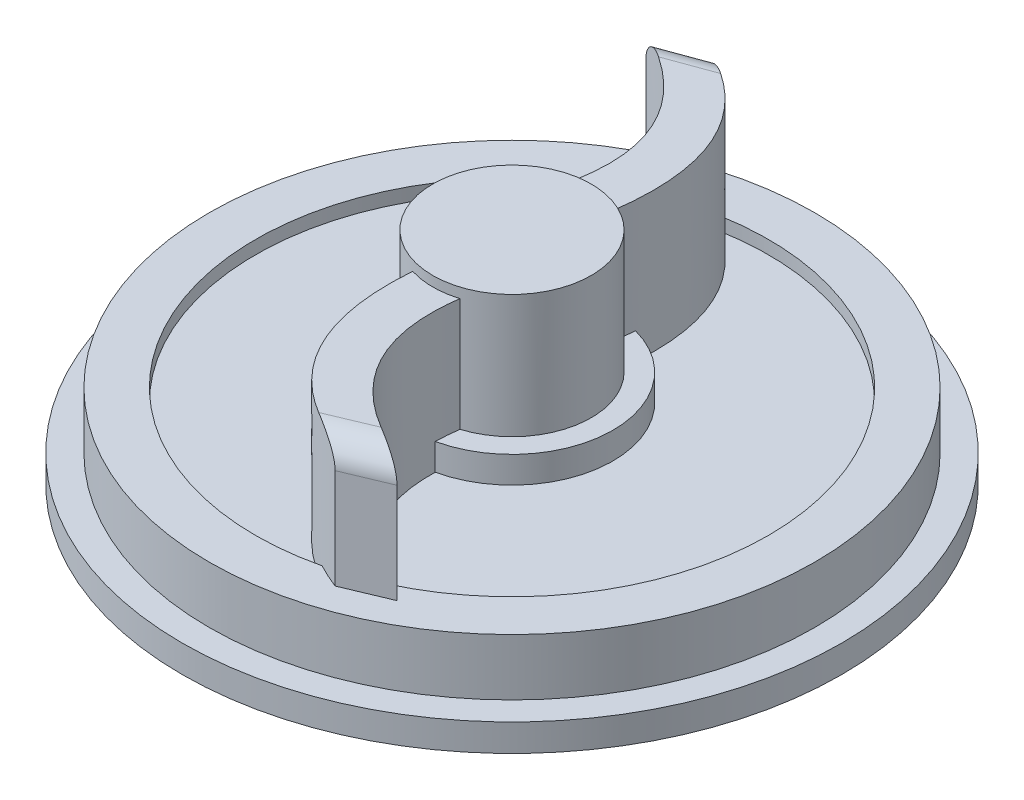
SolidWorks part; units mm, degrees
ref_plane "Front Plane" through (0, 0, 0) normal (0, 0, 1) x (1, 0, 0)
ref_plane "Top Plane" through (0, 0, 0) normal (0, 1, 0) x (1, 0, 0)
ref_plane "Right Plane" through (0, 0, 0) normal (1, 0, 0) x (0, 0, -1)
sketch "Sketch1" plane through (0, 0, 0) normal (0, 1, 0) x (1, 0, 0)
  circle A0 centre (0, 0) radius 12.573
  dimension "D1" = 25.146
extrude "Boss-Extrude1" add sketch "Sketch1" along normal blind 1.0414
sketch "Sketch2" plane through (0, 1.0414, 0) normal (0, 1, 0) x (1, 0, 0)
  line L0 (0, 12.573) -> (0, -12.573) construction
  circle A0 centre (0, 0) radius 12.573 construction
  circle A1 centre (0, 0) radius 11.5443
  dimension "D1" = 23.0886
extrude "Boss-Extrude2" add sketch "Sketch2" along normal blind 2.159
sketch "Sketch3" plane through (0, 3.2004, 0) normal (0, 1, 0) x (1, 0, 0)
  circle A0 centre (0, 0) radius 9.779
  dimension "D1" = 19.558
extrude "Cut-Extrude1" cut sketch "Sketch3" against normal blind 0.508
sketch "Sketch5" plane through (0, 2.6924, 0) normal (0, 1, 0) x (1, 0, 0)
  circle A0 centre (0, 0) radius 3.8481
  dimension "D1" = 7.6962
extrude "Boss-Extrude3" add sketch "Sketch5" along normal blind 1.016
sketch "Sketch6" plane through (0, 3.7084, 0) normal (0, 1, 0) x (1, 0, 0)
  circle A0 centre (0, 0) radius 3.0226
  dimension "D1" = 6.0452
extrude "Boss-Extrude4" add sketch "Sketch6" along normal blind 4.699
sketch "Sketch7" plane through (0, 2.6924, 0) normal (0, 1, 0) x (1, 0, 0)
  line L0 (-0.9017, -2.885) -> (0.9017, -2.885)
  line L1 (0.9017, -2.885) -> (0.2767, -7.3291) construction
  line L2 (0.2767, -7.3291) -> (4.8487, -9.235) construction
  line L4 (-0.9017, -2.885) -> (-1.3121, -8.1823) construction
  line L5 (-1.3121, -8.1823) -> (3.1855, -9.9321) construction
  line L6 (0.2767, -7.3291) -> (-1.3121, -8.1823) construction
  line L7 (-0.9017, -2.885) -> (-0.9017, 2.885) construction
  line L9 (-0.9017, 2.885) -> (0.9017, 2.885)
  line L10 (-4.445, 9.5477) -> (-2.7509, 10.1661)
  line L12 (-4.445, 9.5477) -> (-4.7934, 10.5021) construction
  line L13 (-2.7509, 10.1661) -> (-3.0993, 11.1205) construction
  line L14 (-0.9017, 2.885) -> (0.127, 7.277) construction
  line L15 (4.8487, -9.235) -> (3.1855, -9.9321)
  line L16 (3.1855, -9.9321) -> (3.6176, -10.9628) construction
  line L17 (4.8487, -9.235) -> (5.2808, -10.2657) construction
  line L18 (0.127, 7.277) -> (-4.445, 9.5477) construction
  line L19 (0.9017, 2.885) -> (1.6648, 8.219) construction
  line L20 (1.6648, 8.219) -> (-2.7509, 10.1661) construction
  line L21 (0.127, 7.277) -> (1.6648, 8.219) construction
  circle A0 centre (0, 0) radius 3.0226 construction
  circle A1 centre (0, 0) radius 11.5443 construction
  circle A5 centre (0, 0) radius 3.0226 construction
  circle A6 centre (0, 0) radius 11.5443 construction
  spline S0 degree 2 poles (0.9017, -2.885) (0.2767, -7.3291) (4.8487, -9.235) knots 0 0 0 1 1 1
  spline S1 degree 2 poles (-0.9017, -2.885) (-1.3121, -8.1823) (3.1855, -9.9321) knots 0 0 0 1 1 1
  spline S2 degree 2 poles (-0.9017, 2.885) (0.127, 7.277) (-4.445, 9.5477) knots 0 0 0 1 1 1
  spline S3 degree 2 poles (0.9017, 2.885) (1.6648, 8.219) (-2.7509, 10.1661) knots 0 0 0 1 1 1
  dimension "D1" = 1.8034
  dimension "D2" = 1.8034
  dimension "D3" = 1.1176
  dimension "D4" = 90
  dimension "D5" = 1.1176
  dimension "D6" = 90
  dimension "D7" = 1.8034
  dimension "D8" = 6.35
  dimension "D9" = 4.572
  dimension "D10" = 4.826
  dimension "D11" = 5.2973
  dimension "D12" = 90
  dimension "D13" = 90
  dimension "D14" = 1.016
  dimension "D15" = 1.016
  dimension "D16" = 1.8034
  dimension "D17" = 4.445
  dimension "D18" = 1.8034
  dimension "D19" = 5.334
  dimension "D20" = 4.826
  dimension "D21" = 4.572
extrude "Boss-Extrude6" add sketch "Sketch7" along normal blind 5.334
fillet "Fillet2" radius 1.016 2 edges at (4.0171, 8.0264, 9.5836)
fillet "Fillet3" radius 1.016 2 edges at (-3.598, 8.0264, -9.8569)
sketch "Sketch8" plane through (0, 0, 0) normal (0, -1, 0) x (1, 0, 0)
  circle A0 centre (0, 0) radius 10.0584
  dimension "D1" = 20.1168
extrude "Cut-Extrude2" cut sketch "Sketch8" against normal blind 0.762
sketch "Sketch9" plane through (0, 0.762, 0) normal (0, -1, 0) x (1, 0, 0)
  line L5 (-1.5716, -1.5484) -> (1.5716, 1.5484) construction
  line L6 (-1.5716, 1.5484) -> (1.5716, -1.5484) construction
  circle A0 centre (0, 0) radius 3.3909
  dimension "D1" = 6.7818
extrude "Boss-Extrude7" add sketch "Sketch9" along normal blind 2.794
sketch "Sketch10" plane through (0, -2.032, 0) normal (0, -1, 0) x (1, 0, 0)
  line L1 (-1.778, -1.778) -> (1.778, -1.778)
  line L2 (-1.778, -1.778) -> (-1.778, 1.778)
  line L3 (-1.778, 1.778) -> (1.778, 1.778)
  line L4 (1.778, -1.778) -> (1.778, 1.778)
  line L5 (-1.778, -1.778) -> (1.778, 1.778) construction
  line L6 (-1.778, 1.778) -> (1.778, -1.778) construction
  point P0 (0, 0)
  dimension "D1" = 3.556
  dimension "D2" = 3.556
extrude "Cut-Extrude3" cut sketch "Sketch10" against normal blind 6.35
